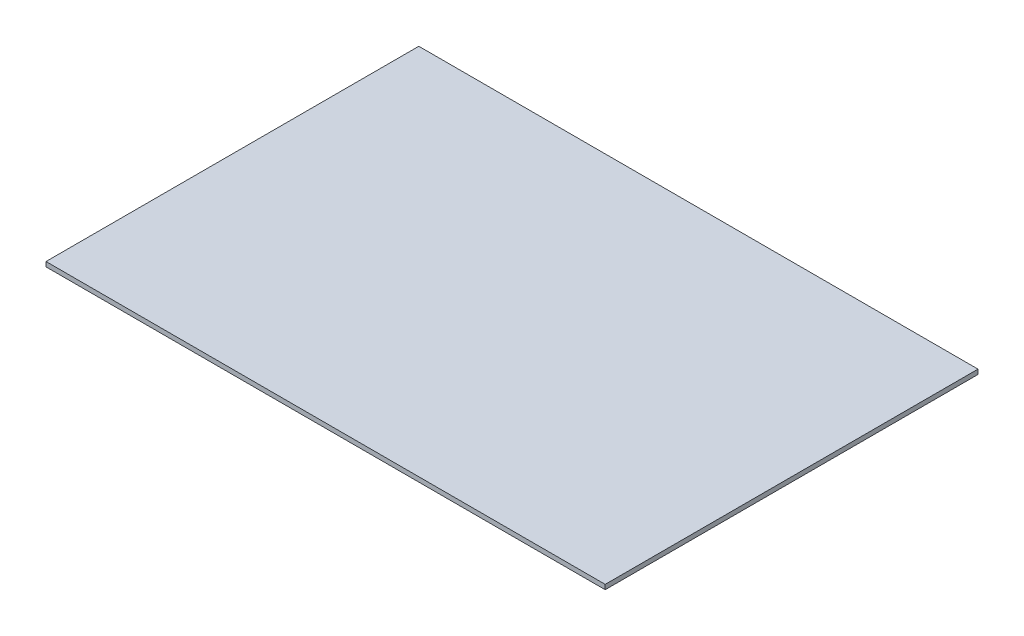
SolidWorks part; units mm, degrees
ref_plane "Front Plane" through (0, 0, 0) normal (0, 0, 1) x (1, 0, 0)
ref_plane "Top Plane" through (0, 0, 0) normal (0, 1, 0) x (1, 0, 0)
ref_plane "Right Plane" through (0, 0, 0) normal (1, 0, 0) x (0, 0, -1)
sketch "Sketch1" plane through (0, 0, 0) normal (0, 1, 0) x (1, 0, 0)
  line L1 (-381, -254) -> (381, -254)
  line L2 (-381, -254) -> (-381, 254)
  line L3 (-381, 254) -> (381, 254)
  line L4 (381, -254) -> (381, 254)
  line L5 (-381, -254) -> (381, 254) construction
  line L6 (-381, 254) -> (381, -254) construction
  point P0 (0, 0)
  dimension "D1" = 762
  dimension "D2" = 508
extrude "Boss-Extrude1" add sketch "Sketch1" along normal blind 6.35
